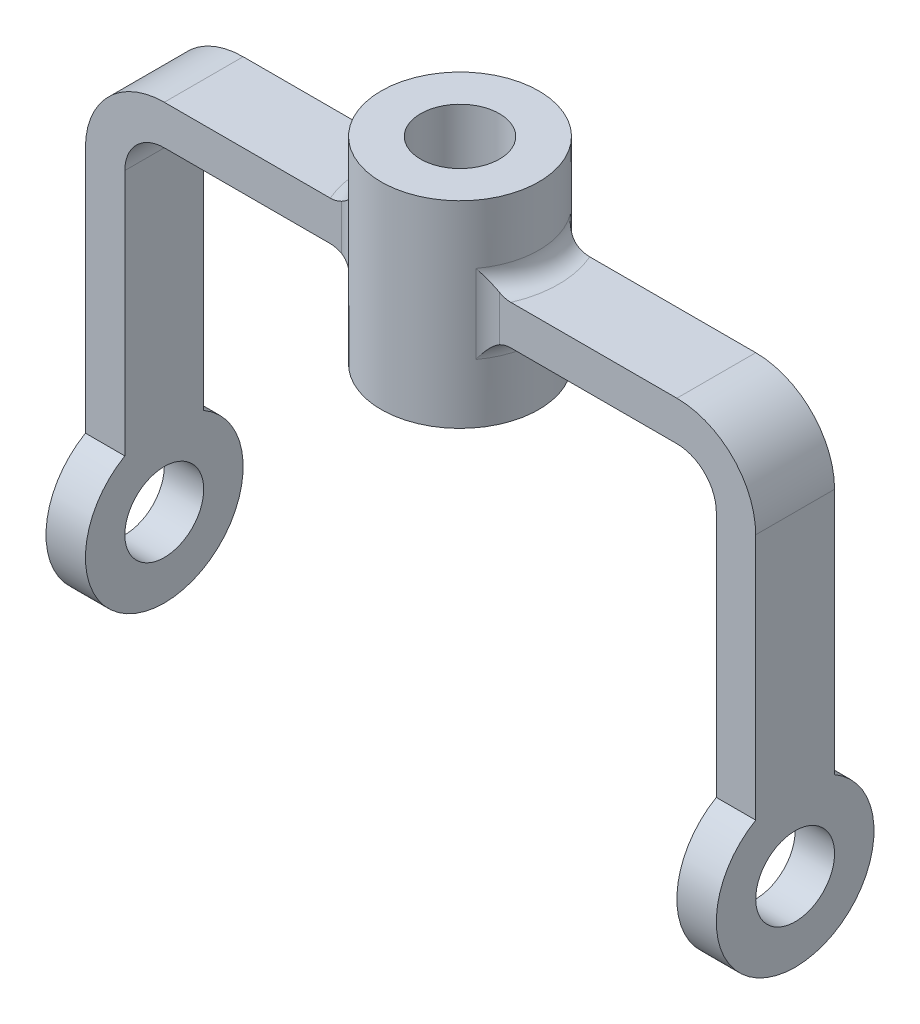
SolidWorks part; units mm, degrees
ref_plane "Front Plane" through (0, 0, 0) normal (0, 0, 1) x (1, 0, 0)
ref_plane "Top Plane" through (0, 0, 0) normal (0, 1, 0) x (1, 0, 0)
ref_plane "Right Plane" through (0, 0, 0) normal (1, 0, 0) x (0, 0, -1)
sketch "Sketch1" plane through (0, 0, 0) normal (0, 0, 1) x (1, 0, 0)
  line L0 (-75, 0) -> (-75, 80)
  line L1 (-65, 90) -> (65, 90)
  line L2 (75, 80) -> (75, 0)
  arc A0 (65, 90) -> (75, 80) centre (65, 80) cw
  arc A1 (-75, 80) -> (-65, 90) centre (-65, 80) cw
  point P4 (0, 90)
  point P5 (0, 0)
  point P9 (75, 90)
  point P12 (-75, 90)
  dimension "D3" = 10
  dimension "D1" = 150
  dimension "D2" = 90
extrude "Extrude-Thin1" add sketch "Sketch1" along normal mid plane 20 thin
sketch "Sketch2" plane through (85, 0, 0) normal (1, 0, 0) x (0, 0, -1)
  circle A0 centre (0, 0) radius 20
  dimension "D1" = 40
extrude "Boss-Extrude1" add sketch "Sketch2" against normal blind 10
mirror "Mirror1" about plane through (0, 0, 0) normal (1, 0, 0) of "Boss-Extrude1"
sketch "Sketch3" plane through (85, 0, 0) normal (1, 0, 0) x (0, 0, -1)
  circle A0 centre (0, 0) radius 10
  dimension "D1" = 20
extrude "Cut-Extrude1" cut sketch "Sketch3" against normal through all
sketch "Sketch4" plane through (0, 0, 0) normal (0, 0, 1) x (1, 0, 0)
  line L0 (0, 120) -> (0, 70) construction
  line L1 (0, 120) -> (20, 120)
  line L2 (20, 120) -> (20, 70)
  line L3 (20, 70) -> (0, 70)
  line L4 (-65, 100) -> (65, 100) construction
  line L5 (0, 120) -> (0, 70)
  point P7 (0, 0)
  dimension "D1" = 20
  dimension "D2" = 50
  dimension "D3" = 20
revolve "Revolve1" add sketch "Sketch4" angle 360 about L0
sketch "Sketch5" plane through (0, 120, 0) normal (0, 1, 0) x (1, 0, 0)
  circle A0 centre (0, 0) radius 10
  dimension "D1" = 20
extrude "Cut-Extrude2" cut sketch "Sketch5" against normal through all
fillet "Fillet1" radius 5 4 edges at (-20, 90, 0) (20, 90, 0) (-20, 100, 0) (20, 100, 0)
fillet "Fillet2" radius 5 4 edges at (-17.3205, 95, -10) (17.3205, 95, -10) (17.3205, 95, 10) (-17.3205, 95, 10)
